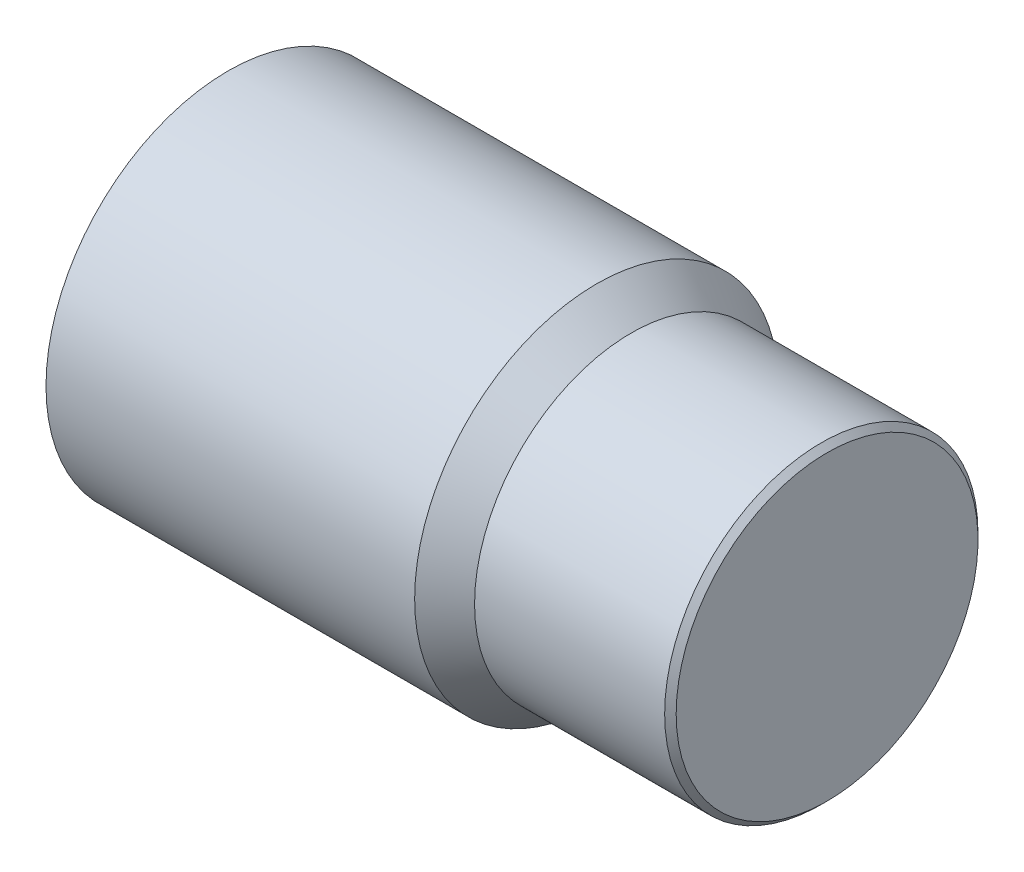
SolidWorks part; units mm, degrees
ref_plane "Front Plane" through (0, 0, 0) normal (0, 0, 1) x (1, 0, 0)
ref_plane "Top Plane" through (0, 0, 0) normal (0, 1, 0) x (1, 0, 0)
ref_plane "Right Plane" through (0, 0, 0) normal (1, 0, 0) x (0, 0, -1)
sketch "Sketch1" plane through (0, 0, 0) normal (1, 0, 0) x (0, 0, -1)
  circle A0 centre (0, 0) radius 3.95
  dimension "D1" = 7.9
extrude "Boss-Extrude1" add sketch "Sketch1" along normal blind 8 contours A0
sketch "Sketch2" plane through (0, 0, 0) normal (0, 1, 0) x (1, 0, 0)
  line L0 (0, 3.95) -> (8, 3.95)
  line L1 (8, -3.95) -> (0, -3.95)
  line L2 (8, -3.95) -> (0, -3.95)
  line L3 (0, 3.95) -> (8, 3.95)
  line L4 (8, 3.95) -> (8, 0)
  line L5 (8, -3.95) -> (8, 3.95) construction
  line L6 (8, 0) -> (13, 0)
  line L7 (13, 0) -> (13, 3.4)
  line L8 (13, 3.4) -> (8.75, 3.4)
  line L9 (8, 3.95) -> (8.75, 3.4)
  dimension "D1" = 3.95
  dimension "D2" = 5
  dimension "D3" = 3.4
  dimension "D4" = 0.75
revolve "Revolve1" add sketch "Sketch2" angle 360 about L6
chamfer "Chamfer1" distance 0.125 angle 45 1 edges at (13, 0, 3.4)
